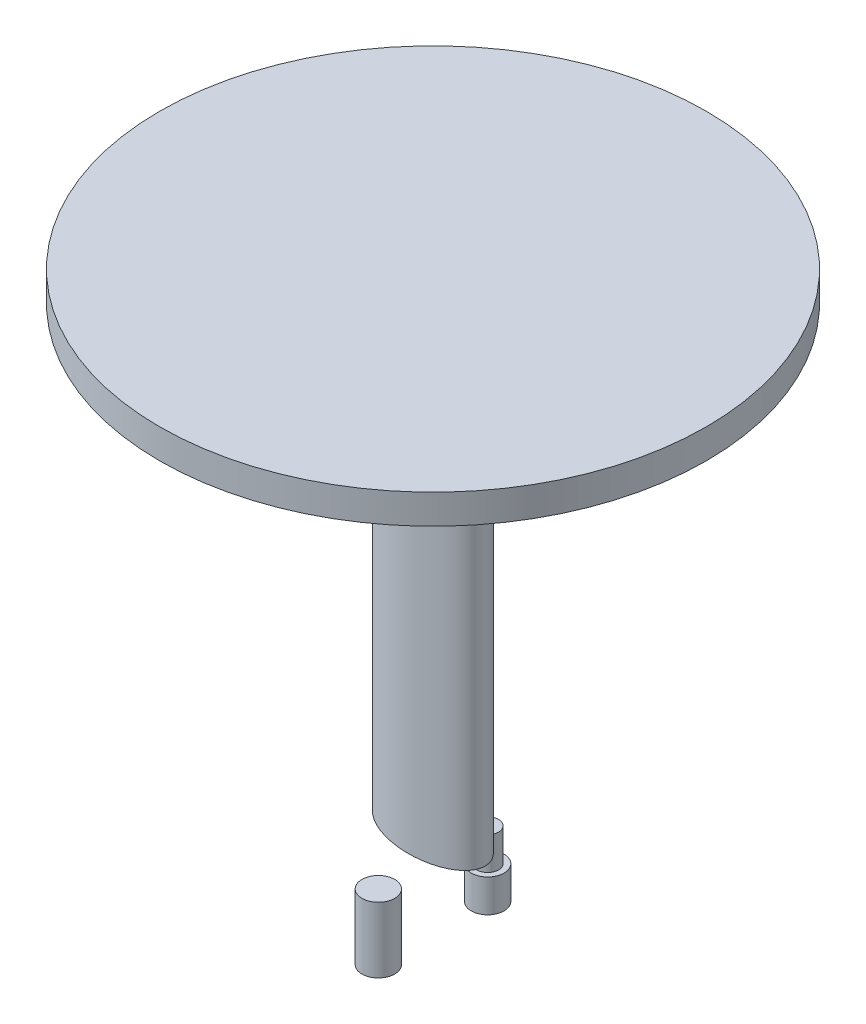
SolidWorks part; units mm, degrees
ref_plane "Płaszczyzna przednia" through (0, 0, 0) normal (0, 0, 1) x (1, 0, 0)
ref_plane "Płaszczyzna górna" through (0, 0, 0) normal (0, 1, 0) x (1, 0, 0)
ref_plane "Płaszczyzna prawa" through (0, 0, 0) normal (1, 0, 0) x (0, 0, -1)
sketch "Szkic1" plane through (0, 0, 0) normal (0, 0, 1) x (1, 0, 0)
  line L3 (0, 0) -> (0, 25) construction
  line L6 (23.5, 43.9) -> (0, 43.9)
  line L7 (23.5, 46.6) -> (25, 46.6) construction
  line L8 (23.5, 46.6) -> (25, 46.6)
  line L9 (25, 46.6) -> (25, 43.9)
  line L10 (25, 43.9) -> (23.5, 43.9)
  line L11 (0, 43.9) -> (0, 46.6)
  line L14 (23.5, 46.6) -> (0, 46.6)
  dimension "D6" = 2.7
revolve "Obrót1" add sketch "Szkic1" angle 360 about L3
sketch "Szkic2" plane through (0, 0, 0) normal (0, -1, 0) x (1, 0, 0)
  line L0 (0, 0) -> (0, 5) construction
  line L1 (0, 5) -> (0, -5) construction
  circle A0 centre (0, 5) radius 1.5
  circle A1 centre (0, -5) radius 1.5
extrude "Dodanie-wyciągnięcie1" add sketch "Szkic2" along normal blind 6
sketch "Szkic3" plane through (0, -6, 0) normal (0, -1, 0) x (1, 0, 0)
  circle A0 centre (0, 5) radius 1
  circle A1 centre (0, -5) radius 1
  circle A2 centre (0, 5) radius 2.3727
  circle A3 centre (0, -5) radius 1.5
extrude "Wytnij-wyciągnięcie2" cut sketch "Szkic3" against normal blind 3 from offset 3
sketch "Szkic5" plane through (0, 2, 0) normal (0, 1, 0) x (1, 0, 0)
  ellipse E0 centre (0, 0) end of major axis (5.0731, -0.4654) minor radius 2.8085
extrude "Dodanie-wyciągnięcie3" add sketch "Szkic5" along normal blind 31
